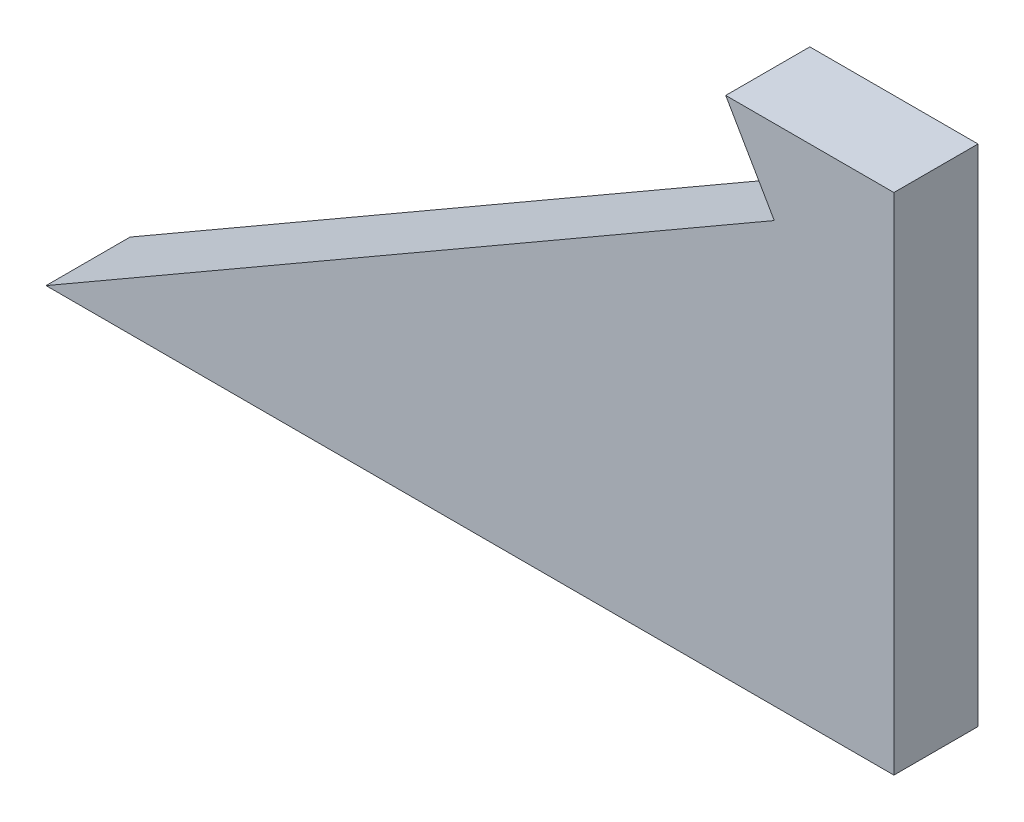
SolidWorks part; units mm, degrees
ref_plane "Front Plane" through (0, 0, 0) normal (0, 0, 1) x (1, 0, 0)
ref_plane "Top Plane" through (0, 0, 0) normal (0, 1, 0) x (1, 0, 0)
ref_plane "Right Plane" through (0, 0, 0) normal (1, 0, 0) x (0, 0, -1)
ref_plane "Plane1" through (0, 0, 0) normal (0, 0, 1) x (1, 0, 0)
sketch "Sketch1" plane through (0, 0, 0) normal (0, 0, 1) x (1, 0, 0)
  line L0 (-14.6647, 25.4) -> (36.1353, 25.4)
  line L1 (36.1353, 25.4) -> (36.1353, -127)
  line L2 (36.1353, -127) -> (-219.9705, -127)
  line L3 (0, 0) -> (-219.9705, -127)
  line L5 (0, 0) -> (-14.6647, 25.4)
  dimension "D1" = 152.4
  dimension "D2" = 254
  dimension "D3" = 50.8
  dimension "D4" = 30
extrude "Extrude1" add sketch "Sketch1" against normal mid plane 25.4
